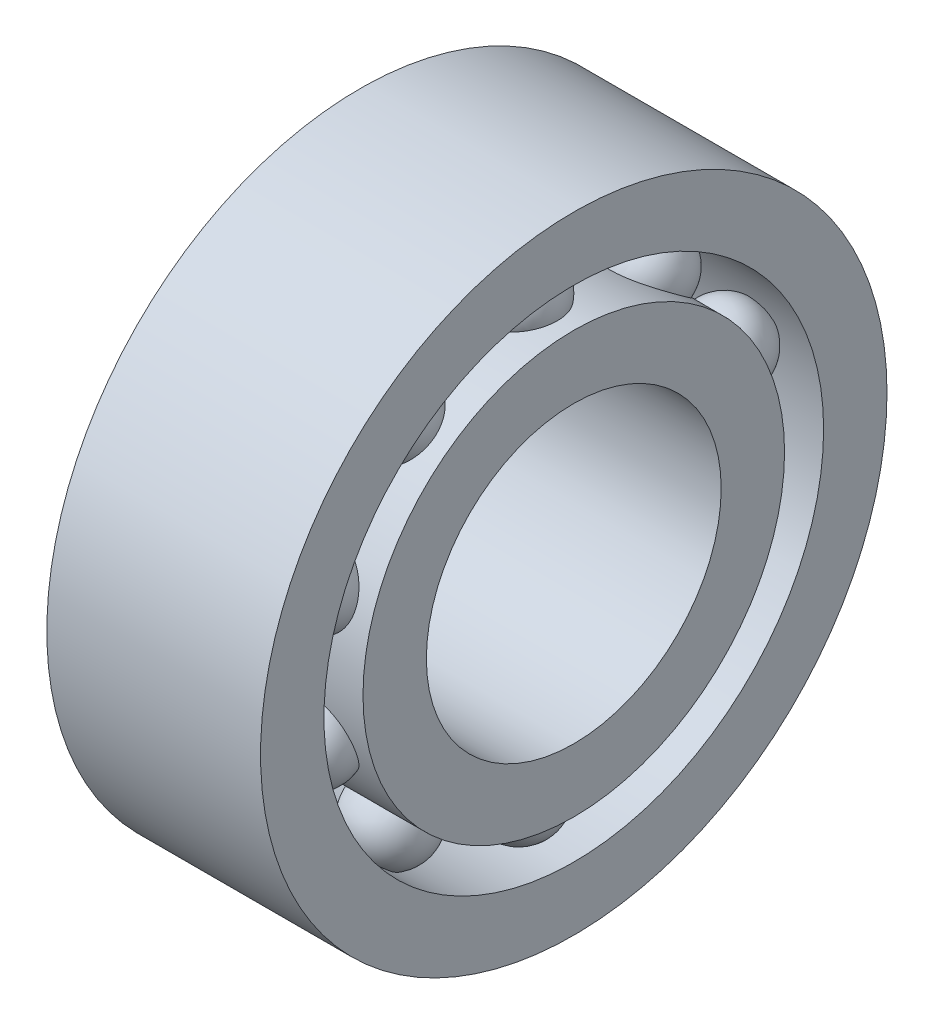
SolidWorks part; units mm, degrees
ref_plane "Front Plane" through (0, 0, 0) normal (0, 0, 1) x (1, 0, 0)
ref_plane "Top Plane" through (0, 0, 0) normal (0, 1, 0) x (1, 0, 0)
ref_plane "Right Plane" through (0, 0, 0) normal (1, 0, 0) x (0, 0, -1)
sketch "Sketch1" plane through (0, 0, 0) normal (0, 0, 1) x (1, 0, 0)
  line L0 (-58, 40) -> (0, 40)
  line L1 (-36.9722, 42) -> (-36.9722, 83) construction
  line L2 (-21.0278, 42) -> (-21.0278, 83) construction
  line L3 (-58, 85) -> (0, 85)
  line L4 (0, 40) -> (0, 57.2)
  line L5 (0, 0) -> (-65, 0) construction
  line L6 (-58, 67.8) -> (0, 67.8)
  line L7 (-58, 85) -> (-58, 67.8)
  line L8 (-58, 57.2) -> (0, 57.2)
  line L9 (0, 67.8) -> (0, 85)
  line L10 (-58, 57.2) -> (-58, 40)
  line L11 (-36.9722, 62.5) -> (-21.0278, 62.5) construction
  line L12 (-29, 62.5) -> (-29, 85) construction
  dimension "D1" = 10.6
  dimension "D2" = 40
  dimension "D3" = 85
  dimension "D7" = 58
revolve "Revolve1" add sketch "Sketch1" angle 360 about L5
sketch "Sketch2" plane through (0, 0, 0) normal (0, 0, 1) x (1, 0, 0)
  line L0 (0, 0) -> (-58, 0) construction
  line L1 (-29, 0) -> (-29, 85) construction
  line L2 (0, 85) -> (-58, 85) construction
  line L3 (-43, 0) -> (-43, 58.75) construction
  line L4 (-32.35, 58.75) -> (-53.65, 58.75)
  line L5 (-32.35, 58.75) -> (-53.65, 58.75) construction
  line L6 (-58, 85) -> (-58, -85) construction
  line L7 (-4.35, 58.75) -> (-25.65, 58.75)
  line L8 (-4.35, 58.75) -> (-25.65, 58.75) construction
  line L9 (-15, 0) -> (-15, 58.75) construction
  line L10 (0, -85) -> (0, 85) construction
  line L11 (-43, 69.4) -> (-15, 69.4) construction
  arc A0 (-32.35, 58.75) -> (-53.65, 58.75) centre (-43, 58.75) ccw
  arc A1 (-4.35, 58.75) -> (-25.65, 58.75) centre (-15, 58.75) ccw
  dimension "D1" = 21.3
  dimension "D2" = 58.75
  dimension "D3" = 15
  dimension "D4" = 15
revolve "Revolve3" add sketch "Sketch2" angle 360 about L5
pattern_circular "CirPattern1" count 10 over 360 about axis through (0, 0, 0) along (1, 0, 0) of "Revolve3"
